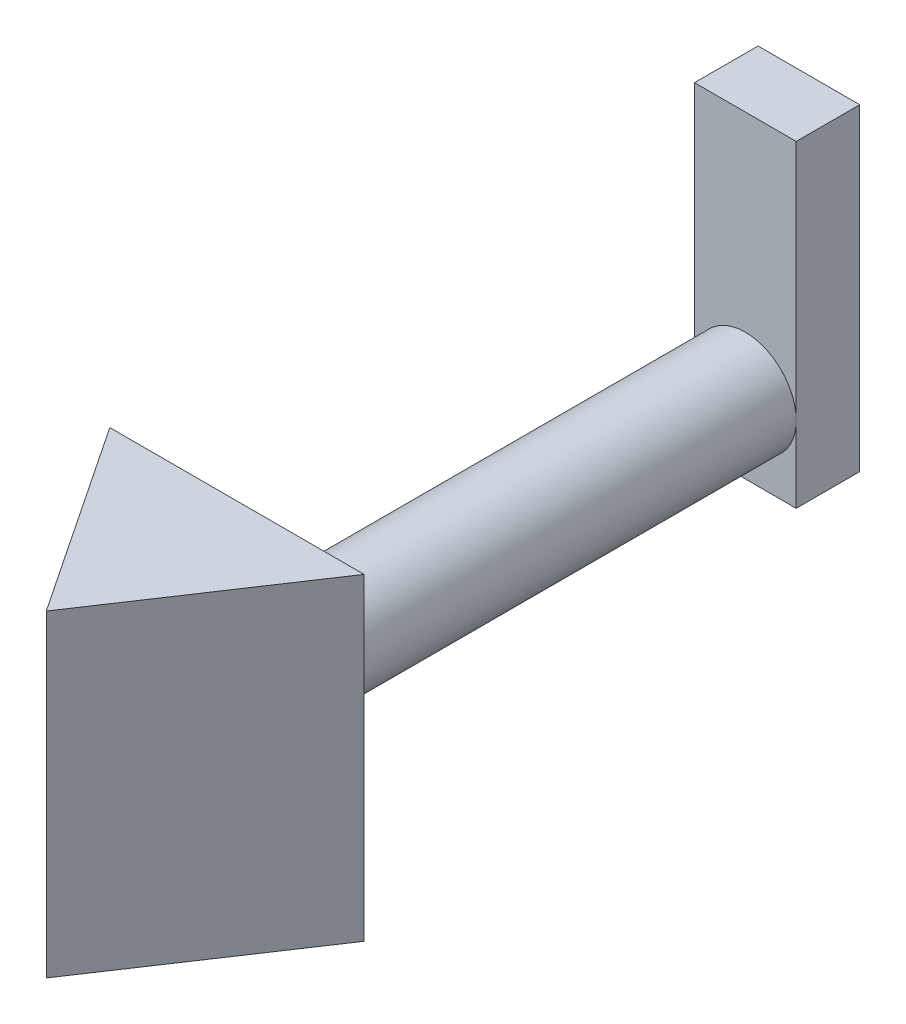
SolidWorks part; units mm, degrees
ref_plane "Plan de face" through (0, 0, 0) normal (0, 0, 1) x (1, 0, 0)
ref_plane "Plan de dessus" through (0, 0, 0) normal (0, 1, 0) x (1, 0, 0)
ref_plane "Plan de droite" through (0, 0, 0) normal (1, 0, 0) x (0, 0, -1)
sketch "Esquisse1" plane through (0, 0, 0) normal (0, 0, 1) x (1, 0, 0)
  circle A0 centre (0, 0) radius 8
extrude "Boss.-Extru.1" add sketch "Esquisse1" along normal blind 80
sketch "Esquisse2" plane through (0, 0, 0) normal (0, 0, -1) x (-1, 0, 0)
  line L1 (-8, -12) -> (8, -12)
  line L2 (-8, -12) -> (-8, 38)
  line L3 (-8, 38) -> (8, 38)
  line L4 (8, -12) -> (8, 38)
  dimension "D1" = 16
  dimension "D2" = 8
  dimension "D3" = 50
  dimension "D4" = 12
extrude "Boss.-Extru.2" add sketch "Esquisse2" along normal blind 10
ref_plane "Plan1" through (0, 0, 10) normal (0, 0, 1) x (1, 0, 0)
sketch "Esquisse3" plane through (0, 0, 10) normal (0, 0, 1) x (1, 0, 0)
  circle A0 centre (0, 0) radius 22
sketch "Esquisse4" plane through (0, 0, 80) normal (0, 0, 1) x (1, 0, 0)
  line L0 (0, 16) -> (0, -16)
  line L1 (0, 19.825) -> (0, -20.368) construction
  arc A0 (0, -16) -> (0, 16) centre (0, 0) ccw
sketch "Esquisse5" plane through (0, 0, 0) normal (0, 1, 0) x (1, 0, 0)
  line L0 (0, -80) -> (20, -80)
  line L1 (0, -80) -> (16, -80) construction
  line L2 (20, -80) -> (0, -110)
  line L3 (0, -110) -> (-20, -80)
  line L4 (-20, -80) -> (0, -80)
  dimension "D1" = 30
  dimension "D2" = 20
  dimension "D3" = 20
extrude "Boss.-Extru.3" add sketch "Esquisse5" along normal mid plane 50
